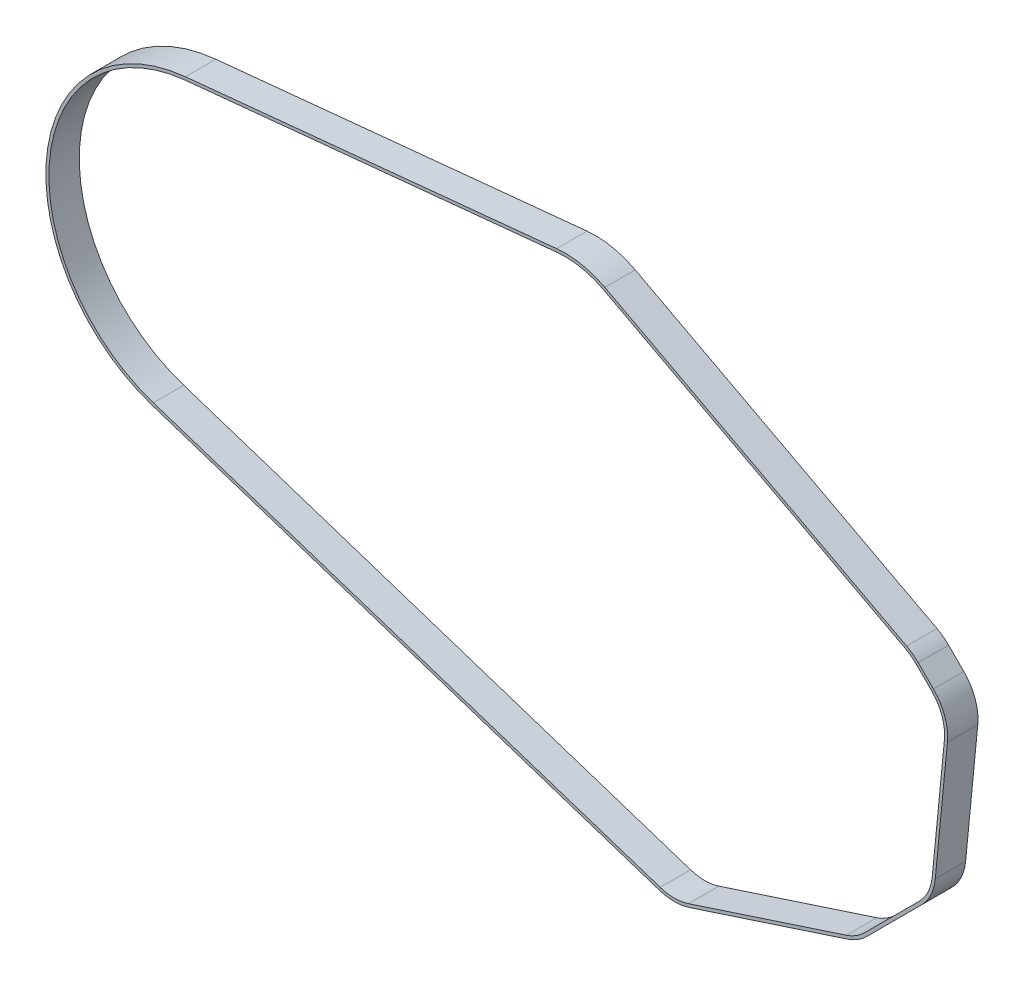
SolidWorks part; units mm, degrees
ref_plane "Front" through (0, 0, 0) normal (0, 0, 1) x (1, 0, 0)
ref_plane "Top" through (0, 0, 0) normal (0, 1, 0) x (1, 0, 0)
ref_plane "Right" through (0, 0, 0) normal (1, 0, 0) x (0, 0, -1)
sketch "Sketch1" plane through (0, 0, 0) normal (0, 0, 1) x (1, 0, 0)
  line L0 (-5.0275, 50.7516) -> (117.2398, 62.8636)
  line L1 (133.0988, 59.7471) -> (232.4851, 7.1412)
  line L2 (236.3137, 4.3137) -> (241.3137, -0.6863)
  line L3 (245.9244, -13.5536) -> (241.9244, -54.5536)
  line L4 (237.3137, -64.3137) -> (219.3137, -82.3137)
  line L5 (212.9718, -86.2079) -> (160.9718, -103.2079)
  line L6 (151.0136, -103.2032) -> (-15.8941, -48.4601)
  line L12 (-4.929, 49.7565) -> (117.3384, 61.8685)
  line L13 (132.631, 58.8633) -> (232.0172, 6.2574)
  line L14 (235.6066, 3.6066) -> (240.6066, -1.3934)
  line L15 (244.9291, -13.4565) -> (240.9291, -54.4565)
  line L16 (236.6066, -63.6066) -> (218.6066, -81.6066)
  line L17 (212.6611, -85.2574) -> (160.6611, -102.2574)
  line L18 (151.3253, -102.253) -> (-15.5825, -47.5099)
  arc A0 (-4.929, 49.7565) -> (-15.5825, -47.5099) centre (0, 0) ccw
  arc A1 (132.631, 58.8633) -> (117.3384, 61.8685) centre (120, 35) ccw
  arc A2 (235.6066, 3.6066) -> (232.0172, 6.2574) centre (225, -7) ccw
  arc A3 (244.9291, -13.4565) -> (240.6066, -1.3934) centre (230, -12) ccw
  arc A4 (236.6066, -63.6066) -> (240.9291, -54.4565) centre (226, -53) ccw
  arc A5 (212.6611, -85.2574) -> (218.6066, -81.6066) centre (208, -71) ccw
  arc A6 (151.3253, -102.253) -> (160.6611, -102.2574) centre (156, -88) ccw
  arc A7 (133.0988, 59.7471) -> (117.2398, 62.8636) centre (120, 35) ccw
  arc A8 (236.3137, 4.3137) -> (232.4851, 7.1412) centre (225, -7) ccw
  arc A9 (245.9244, -13.5536) -> (241.3137, -0.6863) centre (230, -12) ccw
  arc A10 (237.3137, -64.3137) -> (241.9244, -54.5536) centre (226, -53) ccw
  arc A11 (212.9718, -86.2079) -> (219.3137, -82.3137) centre (208, -71) ccw
  arc A12 (151.0136, -103.2032) -> (160.9718, -103.2079) centre (156, -88) ccw
  arc A13 (-5.0275, 50.7516) -> (-15.8941, -48.4601) centre (0, 0) ccw
extrude "Extrude1" add sketch "Sketch1" against normal blind 10
